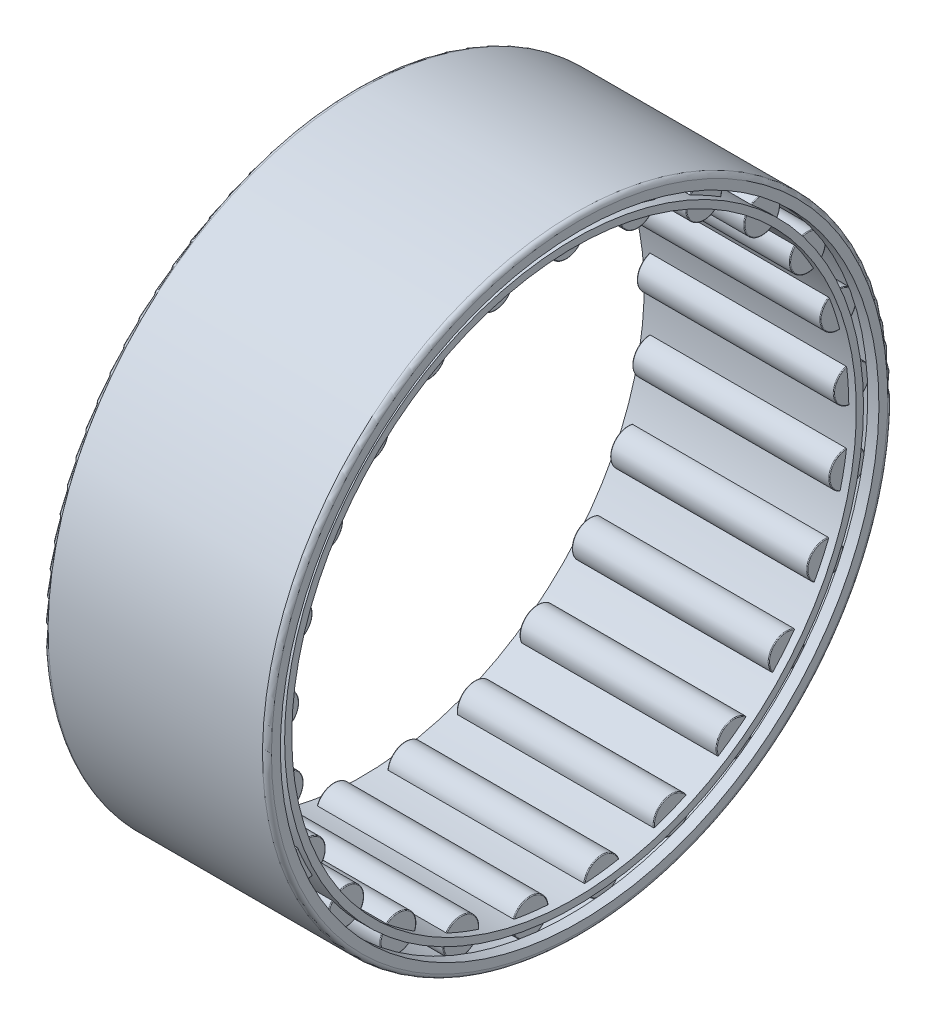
SolidWorks part; units mm, degrees
ref_plane "Plane1" through (0, 0, 0) normal (0, 0, 1) x (1, 0, 0)
ref_plane "Plane2" through (0, 0, 0) normal (0, 1, 0) x (1, 0, 0)
ref_plane "Plane3" through (0, 0, 0) normal (1, 0, 0) x (0, 0, -1)
sketch "Clipboard" plane through (0, 0, 0) normal (0, 0, 1) x (1, 0, 0)
  line L0 (-10, 0) -> (10, 0) construction
  line L1 (0, 0) -> (20.2657, -9.45)
  line L2 (0, 0) -> (36.8323, 17.1752)
  line L3 (0, 0) -> (20.2657, -9.45)
  line L4 (0, 0) -> (-76.2, -2.661)
  dimension "BallCLRad" = 40.64
  dimension "Count" = 25
  dimension "Show_count" = 25
  dimension "Max_count" = 25
  dimension "Min_count" = 2
  dimension "Bore" = 76.2
sketch "InnRacSke" plane through (0, 0, 0) normal (0, 0, 1) x (1, 0, 0)
  line L0 (-14.2875, 42.545) -> (-15.875, 42.545)
  line L1 (-15.875, 42.545) -> (-15.875, 43.815)
  line L2 (-15.24, 44.45) -> (15.24, 44.45)
  line L4 (15.875, 43.815) -> (15.875, 42.545)
  line L5 (15.875, 42.545) -> (14.2875, 42.545)
  line L6 (14.2875, 42.545) -> (14.2875, 43.18)
  line L7 (14.2875, 43.18) -> (-14.2875, 43.18)
  line L8 (-14.2875, 43.18) -> (-14.2875, 42.545)
  line L9 (-31.75, 0) -> (31.75, 0) construction
  arc A0 (-15.875, 43.815) -> (-15.24, 44.45) centre (-15.24, 43.815) cw
  arc A2 (15.24, 44.45) -> (15.875, 43.815) centre (15.24, 43.815) cw
  dimension "radius" = 0.635
  dimension "D1" = 86.36
  dimension "OD" = 88.9
  dimension "Width" = 31.75
  dimension "groove_dp" = 0.635
  dimension "Cyl_Len" = 28.575
  dimension "halfCyl" = 14.2875
revolve "Race" add sketch "InnRacSke" angle 360 about L9
sketch "RolDetSke" plane through (0, 0, 0) normal (0, 0, 1) x (1, 0, 0)
  line L0 (-14.0018, 43.0789) -> (-14.0017, 40.64)
  line L1 (-14.0017, 40.64) -> (14.0017, 40.64)
  line L2 (14.0017, 40.64) -> (14.0018, 43.0789)
  line L3 (13.9001, 43.1805) -> (-13.9001, 43.1805)
  line L4 (-28.575, 40.64) -> (28.575, 40.64) construction
  arc A0 (14.0018, 43.0789) -> (13.9001, 43.1805) centre (13.9001, 43.0789) ccw
  arc A1 (-13.9001, 43.1805) -> (-14.0018, 43.0789) centre (-13.9001, 43.0789) ccw
  dimension "Roller_radius" = 0.1016
  dimension "Roller_diameter" = 5.081
  dimension "Roller_length" = 28.0035
  dimension "RollerCLRad" = 40.64
  dimension "halfLength" = 14.0017
revolve "RollerDetailed" add sketch "RolDetSke" angle 360 about L4
ref_axis "Axis1" through (-50, 0, 0) along (1, 0, 0)
sketch "CagSpiSke" plane through (0, 0, 0) normal (0, 0, 1) x (1, 0, 0)
  line L0 (15.0812, 40.1319) -> (15.0812, 41.1481)
  line L1 (15.0812, 41.1481) -> (-15.0813, 41.1481)
  line L2 (-15.0813, 41.1481) -> (-15.0813, 40.1319)
  line L3 (-15.0813, 40.1319) -> (15.0812, 40.1319)
  line L4 (-31.75, 0) -> (31.75, 0) construction
  dimension "Cage_width" = 30.1625
  dimension "D2" = 80.2638
  dimension "Cage_thickness" = 1.0162
  dimension "halfWidth" = 15.0813
revolve "CageSpine" add sketch "CagSpiSke" angle 360 about L4
pattern_circular "RollersDetailed" count 25 every 14.4 about axis through (-50, 0, 0) along (1, 0, 0) of "RollerDetailed"
sketch "RolSimSke" plane through (0, 0, 0) normal (0, 0, 1) x (1, 0, 0)
  line L0 (-25.4, 0) -> (25.4, 0) construction
  line L2 (-13.9001, 43.181) -> (13.9001, 43.181)
  line L3 (-14.0018, 43.0794) -> (-14.0018, 38.2016)
  line L4 (-13.9001, 38.1) -> (13.9001, 38.1)
  line L5 (14.0017, 43.0794) -> (14.0017, 38.2016)
  arc A0 (-14.0018, 38.2016) -> (-13.9001, 38.1) centre (-13.9001, 38.2016) ccw
  arc A1 (-13.9001, 43.181) -> (-14.0018, 43.0794) centre (-13.9001, 43.0794) ccw
  arc A2 (14.0017, 43.0794) -> (13.9001, 43.181) centre (13.9001, 43.0794) ccw
  arc A3 (13.9001, 38.1) -> (14.0017, 38.2016) centre (13.9001, 38.2016) ccw
  point P10 (-14.0018, 38.1)
  point P15 (14.0017, 43.181)
  point P18 (14.0017, 38.1)
  dimension "D1" = 0.1016
  dimension "Bore" = 76.2
  dimension "Roller_length" = 28.0035
  dimension "Roller_diameter" = 5.081
  dimension "halfWidth" = 14.0017
revolve "RollersSimplified" [suppressed] add sketch "RolSimSke" angle 360 about L0
equation "\"BallCLRad@Clipboard\" =  ( \"D1@InnRacSke\" + \"Bore@Clipboard\" )  / 4"
equation "\"RollerCLRad@RolDetSke\" = \"BallCLRad@Clipboard\""
equation "\"halfCyl@InnRacSke\" = \"Cyl_Len@InnRacSke\" / 2"
equation "\"Roller_length@RolDetSke\" = \"Cyl_Len@InnRacSke\" * .98"
equation "\"halfLength@RolDetSke\" = \"Roller_length@RolDetSke\" / 2"
equation "\"Roller_diameter@RolDetSke\" =  ( \"D1@InnRacSke\" - \"Bore@Clipboard\" )  / 2 + .001"
equation "\"Roller_radius@RolDetSke\" = \"Roller_diameter@RolDetSke\" / 50"
equation "\"Cage_width@CagSpiSke\" =  ( \"Cyl_Len@InnRacSke\" + \"Width@InnRacSke\" )  / 2"
equation "\"halfWidth@CagSpiSke\" = \"Cage_width@CagSpiSke\" / 2"
equation "\"Cage_thickness@CagSpiSke\"  = \"Roller_diameter@RolDetSke\" / 5"
equation "\"D2@CagSpiSke\" =  \"RollerCLRad@RolDetSke\" * 2 - \"Cage_thickness@CagSpiSke\""
equation "\"Roller_length@RolSimSke\" = \"Cyl_Len@InnRacSke\" * .98"
equation "\"halfWidth@RolSimSke\" = \"Roller_length@RolSimSke\" / 2"
equation "\"D1@RolSimSke\" = \"Roller_radius@RolDetSke\""
equation "\"Roller_diameter@RolSimSke\" =  ( \"D1@InnRacSke\" - \"Bore@Clipboard\" )  / 2 + .001"
equation "\"Bore@RolSimSke\" = \"Bore@Clipboard\""
equation "\"Max_count@Clipboard\" = int( 3.14159265 / atn(( \"Roller_diameter@RolDetSke\" / 2) / sqr( \"RollerCLRad@RolDetSke\"  *  \"RollerCLRad@RolDetSke\" - ( \"Roller_diameter@RolDetSke\" / 2) *  ( \"Roller_diameter@R"
equation "\"Max_count@Clipboard\" = ((sgn( \"Max_count@Clipboard\" - \"Count@Clipboard\" )-1)*( \"Max_count@Clipboard\" - \"Count@Clipboard\" ))/-2+ \"Count@Clipboard\""
equation "\"Count@RollersDetailed\" = int( \"Show_count@Clipboard\" ) "
equation "\"Count@RollersDetailed\" = ((sgn( \"Count@RollersDetailed\" - \"Max_count@Clipboard\" )-1)*( \"Count@RollersDetailed\" - \"Max_count@Clipboard\" ))/-2+ \"Max_count@Clipboard\""
equation "\"Count@RollersDetailed\" = ((sgn( \"Count@RollersDetailed\" - \"Min_count@Clipboard\" )+1)*( \"Count@RollersDetailed\" - \"Min_count@Clipboard\"))/2 +\"Min_count@Clipboard\""
equation "\"Angle@RollersDetailed\" = 360.0 / \"Max_count@Clipboard\""
equation "\"Angle@CageSpine\" =  \"Angle@RollersDetailed\" * ( \"Count@RollersDetailed\" -1 + int( \"Count@RollersDetailed\" / \"Max_count@Clipboard\" ) )  + 0.001 -  int( \"Count@RollersDetailed\" / \"Max_count@Clipboard\" "
equation "\"Angle@CageSpine\" =  \"Angle@CageSpine\" * int( \"Min_count@Clipboard\" / 2) + int(1 / \"Min_count@Clipboard\")  * 0.001"
